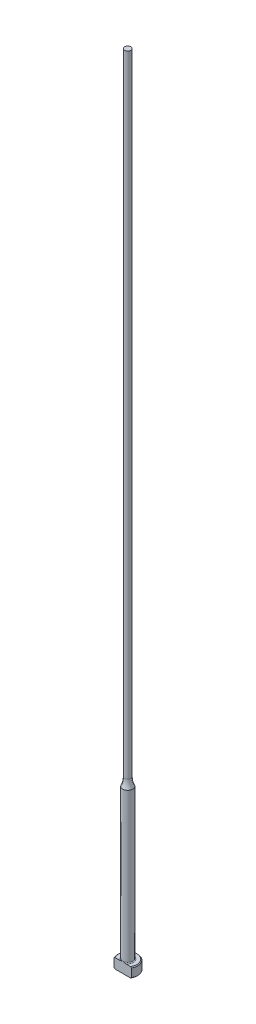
SolidWorks part; units mm, degrees
ref_plane "Front Plane" through (0, 0, 0) normal (0, 0, 1) x (1, 0, 0)
ref_plane "Top Plane" through (0, 0, 0) normal (0, 1, 0) x (1, 0, 0)
ref_plane "Right Plane" through (0, 0, 0) normal (1, 0, 0) x (0, 0, -1)
sketch "Sketch1" plane through (0, 0, 0) normal (0, 0, 1) x (1, 0, 0)
  line L0 (0, 259.9588) -> (0, -15.1925) construction
  line L1 (0, 0) -> (-3.175, 0)
  line L2 (-3.175, 0) -> (-3.175, 3.175)
  line L3 (-3.175, 3.175) -> (-1.5875, 3.175)
  line L4 (-0.9919, 53.4851) -> (-0.9919, 254)
  line L5 (-0.9919, 254) -> (0, 254)
  line L6 (0, 254) -> (0, 0)
  line L7 (-1.5875, 3.175) -> (-1.5875, 50.8)
  arc A0 (-1.5875, 50.8) -> (-0.9919, 53.4851) centre (-7.3419, 53.4851) ccw
  point P13 (-1.5875, 0)
  dimension "D1" = 6.35
  dimension "L" = 254
  dimension "D2" = 3.175
  dimension "H" = 6.35
  dimension "T" = 3.175
  dimension "D" = 1.9837
  dimension "S" = 50.8
revolve "Revolve1" add sketch "Sketch1" angle 360 about L0
chamfer "Chamfer1" distance 0.254 angle 45 2 edges at (0, 3.175, 3.175) (0, 0, 3.175)
fillet "Fillet1" radius 0.254 1 edges at (0, 3.175, 1.5875)
sketch "Sketch2" plane through (0, 0, 0) normal (0, -1, 0) x (1, 0, 0)
  line L0 (-2.7496, 1.5875) -> (2.7496, 1.5875)
  arc A0 (2.7496, 1.5875) -> (-2.7496, 1.5875) centre (0, 0) ccw
  circle A1 centre (0, 0) radius 3.175 construction
  circle A2 centre (0, 0) radius 1.5875 construction
extrude "Cut-Extrude1" cut sketch "Sketch2" against normal through all
